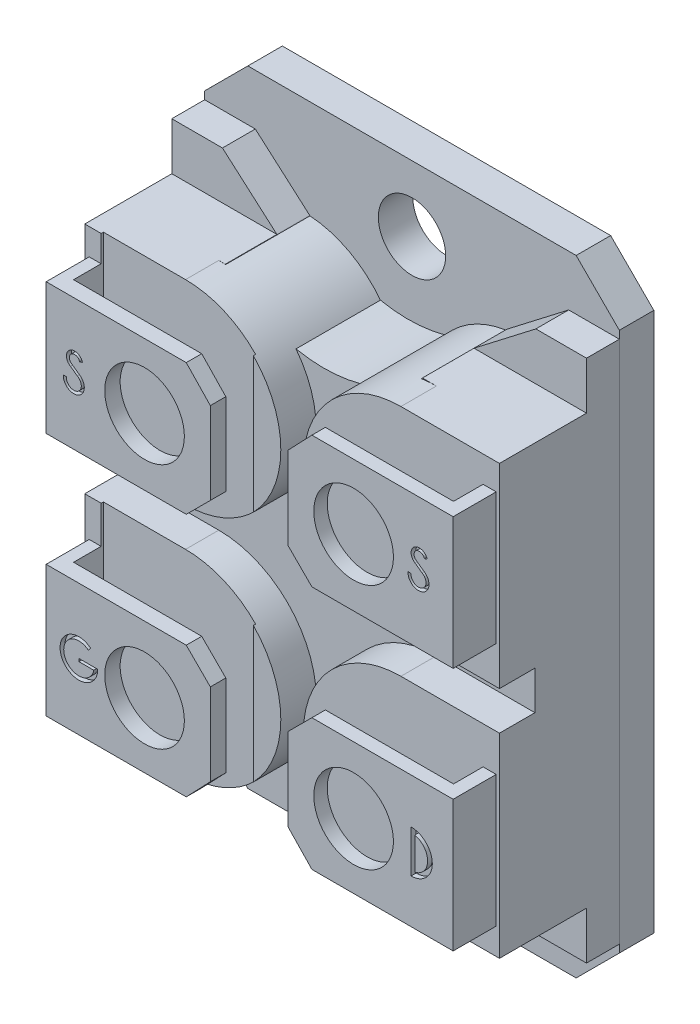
SolidWorks part; units mm, degrees
ref_plane "Front Plane" through (0, 0, 0) normal (0, 0, 1) x (1, 0, 0)
ref_plane "Top Plane" through (0, 0, 0) normal (0, 1, 0) x (1, 0, 0)
ref_plane "Right Plane" through (0, 0, 0) normal (1, 0, 0) x (0, 0, -1)
sketch "Sketch1" plane through (0, 0, 0) normal (0, 0, 1) x (1, 0, 0)
  line L0 (12.625, 60.3009) -> (12.625, -9.7877) construction
  line L1 (2.63, 0) -> (10.575, 0)
  line L2 (0, 2.63) -> (0, 35.47)
  line L3 (2.63, 38.1) -> (22.62, 38.1)
  line L4 (25.25, 2.63) -> (25.25, 35.47)
  line L5 (-10.9957, 19.05) -> (41.3267, 19.05) construction
  line L6 (2.63, 0) -> (0, 2.63)
  line L7 (22.62, 38.1) -> (25.25, 35.47)
  line L8 (22.62, 0) -> (25.25, 2.63)
  line L9 (14.675, 0) -> (22.62, 0)
  line L10 (2.63, 38.1) -> (0, 35.47)
  line L11 (10.575, 3.85) -> (10.575, 0)
  line L12 (14.675, 3.85) -> (14.675, 0)
  arc A0 (14.675, 3.85) -> (10.575, 3.85) centre (12.625, 3.85) ccw
  circle A1 centre (12.625, 34.1) radius 2.05
  dimension "D8" = 4.1
  dimension "D10" = 4.1
  dimension "D1" = 2.63
  dimension "D2" = 2.63
  dimension "D3" = 32.84
  dimension "D4" = 2.63
  dimension "D5" = 19.99
  dimension "D6" = 3.7194
  dimension "D7" = 3.85
  dimension "D9" = 4
extrude "Extrude1" add sketch "Sketch1" along normal blind 2.1
sketch "Sketch2" plane through (0, 0, 2.1) normal (0, 0, 1) x (1, 0, 0)
  line L0 (12.625, 40.0046) -> (12.625, -0.5619) construction
  line L1 (-6.4568, 19.05) -> (27.3251, 19.05) construction
  line L2 (0, 32.1) -> (0, 20.225)
  line L3 (0, 35.47) -> (0, 2.63) construction
  line L4 (0, 20.225) -> (6, 20.225)
  line L5 (0, 32.1) -> (6, 32.1)
  line L6 (0, 6) -> (6, 6)
  line L7 (0, 6) -> (0, 17.875)
  line L8 (0, 17.875) -> (6, 17.875)
  line L9 (25.25, 32.1) -> (19.25, 32.1)
  line L10 (25.25, 32.1) -> (25.25, 20.225)
  line L11 (25.25, 20.225) -> (19.25, 20.225)
  line L12 (25.25, 17.875) -> (19.25, 17.875)
  line L13 (25.25, 6) -> (25.25, 17.875)
  line L14 (25.25, 6) -> (19.25, 6)
  arc A0 (6, 20.225) -> (6, 32.1) centre (6, 26.1625) ccw
  arc A1 (6, 17.875) -> (6, 6) centre (6, 11.9375) cw
  arc A2 (19.25, 20.225) -> (19.25, 32.1) centre (19.25, 26.1625) cw
  arc A3 (19.25, 17.875) -> (19.25, 6) centre (19.25, 11.9375) ccw
  dimension "D3" = 5.9375
  dimension "D5" = 6
  dimension "D1" = 19.05
  dimension "D2" = 12.625
  dimension "D4" = 11.875
  dimension "D6" = 6
extrude "Extrude2" add sketch "Sketch2" along normal blind 7.3
sketch "Sketch3" plane through (0, 0, 2.1) normal (0, 0, 1) x (1, 0, 0)
  line L0 (-7.4463, 19.05) -> (33.1909, 19.05) construction
  line L1 (0, 35.47) -> (0, 32.1) construction
  line L2 (0, 35) -> (3.0841, 35)
  line L3 (3.0841, 35) -> (6.4, 32.1)
  line L4 (25.25, 35) -> (22.1659, 35)
  line L5 (25.25, 32.1) -> (25.25, 35.47) construction
  line L6 (22.1659, 35) -> (18.4, 32.1)
  line L7 (0, 3.1) -> (3.0841, 3.1)
  line L8 (3.0841, 3.1) -> (6.4, 6)
  line L9 (0, 32.1) -> (0, 20.225) construction
  line L10 (25.25, 3.1) -> (22.1659, 3.1)
  line L11 (22.1659, 3.1) -> (18.4, 6)
  line L12 (0, 35) -> (0, 3.1)
  line L13 (25.25, 35) -> (25.25, 3.1)
  arc A0 (6.4, 32.1) -> (18.4, 32.1) centre (12.4, 38.1) ccw
  arc A3 (6.4, 6) -> (18.4, 6) centre (12.4, 0) cw
  dimension "D9" = 19.05
  dimension "D5" = 8.4853
  dimension "D1" = 3.1
  dimension "D2" = 3.0841
  dimension "D3" = 3.0841
  dimension "D4" = 2.9
  dimension "D6" = 12
  dimension "D7" = 6.4
  dimension "D8" = 12.4
extrude "Extrude3" add sketch "Sketch3" along normal blind 5.14
sketch "Sketch4" plane through (0, 0, 7.24) normal (0, 0, 1) x (1, 0, 0)
  line L0 (19.25, 32.1) -> (25.25, 32.1) construction
  line L1 (0, 35) -> (25.25, 35)
  line L2 (0, 35) -> (0, 32.1)
  line L3 (0, 32.1) -> (25.25, 32.1)
  line L4 (25.25, 35) -> (25.25, 32.1)
  line L5 (0, 19.05) -> (31.7068, 19.05) construction
  line L6 (0, 20.225) -> (0, 17.875) construction
  line L7 (25.25, 3.1) -> (25.25, 6)
  line L8 (0, 3.1) -> (25.25, 3.1)
  line L9 (0, 3.1) -> (0, 6)
  line L10 (0, 6) -> (25.25, 6)
  dimension "D1" = 25.25
extrude "Cut-Extrude1" cut sketch "Sketch4" against normal blind 3.14
sketch "Sketch5" plane through (0, 0, 9.4) normal (0, 0, 1) x (1, 0, 0)
  line L0 (0, 32.1) -> (0, 20.225) construction
  line L1 (0, 30.5) -> (8.8, 30.5)
  line L2 (0, 30.5) -> (0, 22.5)
  line L3 (0, 22.5) -> (8.8, 22.5)
  line L4 (10.2666, 28.9666) -> (10.2666, 23.9666)
  line L5 (0, 19.05) -> (32.5245, 19.05) construction
  line L6 (0, 20.225) -> (0, 17.875) construction
  line L7 (10.2666, 23.9666) -> (8.8, 22.5)
  line L8 (0, 7.6) -> (0, 15.6)
  line L9 (10.2666, 28.9666) -> (8.8, 30.5)
  line L10 (0, 7.6) -> (8.8, 7.6)
  line L11 (10.2666, 9.1334) -> (8.8, 7.6)
  line L12 (10.2666, 9.1334) -> (10.2666, 14.1334)
  line L13 (10.2666, 14.1334) -> (8.8, 15.6)
  line L14 (0, 15.6) -> (8.8, 15.6)
  line L15 (12.625, 38.1) -> (12.625, -1.2686) construction
  line L16 (22.62, 38.1) -> (2.63, 38.1) construction
  line L17 (14.9834, 23.9666) -> (16.45, 22.5)
  line L18 (14.9834, 28.9666) -> (14.9834, 23.9666)
  line L19 (14.9834, 28.9666) -> (16.45, 30.5)
  line L20 (25.25, 30.5) -> (16.45, 30.5)
  line L21 (25.25, 30.5) -> (25.25, 22.5)
  line L22 (25.25, 22.5) -> (16.45, 22.5)
  line L23 (14.9834, 14.1334) -> (16.45, 15.6)
  line L24 (14.9834, 9.1334) -> (14.9834, 14.1334)
  line L25 (14.9834, 9.1334) -> (16.45, 7.6)
  line L26 (25.25, 7.6) -> (16.45, 7.6)
  line L27 (25.25, 7.6) -> (25.25, 15.6)
  line L28 (25.25, 15.6) -> (16.45, 15.6)
  dimension "D1" = 8
  dimension "D2" = 7.6
  dimension "D3" = 8.8
  dimension "D4" = 8.8
  dimension "D5" = 5
  dimension "D6" = 1.4666
  dimension "D7" = 1.4666
extrude "Extrude4" add sketch "Sketch5" along normal blind 2.62
ref_plane "Plane1" through (14.9834, 0, 0) normal (-1, 0, 0) x (0, 0, 1)
sketch "Sketch6" plane through (14.9834, 0, 0) normal (-1, 0, 0) x (0, 0, 1)
  line L1 (9.4, 30.5) -> (11.2, 30.5)
  line L2 (9.4, 30.5) -> (9.4, 7.6)
  line L3 (9.4, 7.6) -> (11.2, 7.6)
  line L4 (11.2, 30.5) -> (11.2, 7.6)
  dimension "D1" = 1.8
  dimension "D2" = 22.9
extrude "Cut-Extrude2" cut sketch "Sketch6" against normal blind 9.27
ref_plane "Plane2" through (25.25, 0, 0) normal (1, 0, 0) x (0, 0, -1)
sketch "Sketch7" plane through (25.25, 0, 0) normal (1, 0, 0) x (0, 0, -1)
  line L1 (-14.223, 31.5238) -> (-9.4, 31.5238)
  line L2 (-14.223, 31.5238) -> (-14.223, 5.1627)
  line L3 (-14.223, 5.1627) -> (-9.4, 5.1627)
  line L4 (-9.4, 31.5238) -> (-9.4, 5.1627)
extrude "Cut-Extrude4" cut sketch "Sketch7" against normal blind 0.2
ref_plane "Plane3" through (10.2666, 0, 0) normal (1, 0, 0) x (0, 0, -1)
sketch "Sketch8" plane through (10.2666, 0, 0) normal (1, 0, 0) x (0, 0, -1)
  line L1 (-9.2639, 32.3506) -> (-11.079, 32.3506)
  line L2 (-9.2639, 32.3506) -> (-9.2639, 4.4395)
  line L3 (-9.2639, 4.4395) -> (-11.079, 4.4395)
  line L4 (-11.079, 32.3506) -> (-11.079, 4.4395)
extrude "Cut-Extrude6" cut sketch "Sketch8" against normal blind 9.27
sketch "Sketch9" plane through (0, 0, 0) normal (-1, 0, 0) x (0, 0, 1)
  line L1 (12.02, 30.5) -> (9.4, 30.5)
  line L2 (12.02, 30.5) -> (12.02, 6)
  line L3 (12.02, 6) -> (9.4, 6)
  line L4 (9.4, 30.5) -> (9.4, 6)
extrude "Cut-Extrude7" cut sketch "Sketch9" against normal blind 0.27
sketch "Sketch10" plane through (0, 0, 12.02) normal (0, 0, 1) x (1, 0, 0)
  line L0 (6.26, 39.722) -> (6.26, -1.4806) construction
  line L1 (18.99, 39.722) -> (18.99, -1.4806) construction
  line L2 (34.6044, 26.55) -> (-11.7573, 26.55) construction
  line L3 (-8.789, 11.55) -> (32.5549, 11.55) construction
  circle A0 centre (6.26, 26.55) radius 2.425
  circle A1 centre (18.99, 11.55) radius 2.425
  circle A2 centre (18.99, 26.55) radius 2.425
  circle A3 centre (6.26, 11.55) radius 2.425
  dimension "D5" = 4.85
  dimension "D1" = 15
  dimension "D2" = 11.55
  dimension "D3" = 12.73
  dimension "D4" = 6.26
extrude "Cut-Extrude8" cut sketch "Sketch10" against normal blind 1
sketch "Sketch11" plane through (0, 0, 12.02) normal (0, 0, 1) x (1, 0, 0)
  line L0 (2.3217, 26.5957) -> (1.8189, 26.951)
  line L1 (1.7403, 26.7864) -> (2.1693, 26.4762)
  line L2 (2.3101, 27.2995) -> (2.4839, 27.3492)
  line L3 (1.497, 26.106) -> (1.3152, 26.1189)
  arc A0 (2.4839, 27.3492) -> (1.7403, 26.7864) centre (2.0031, 27.2118) ccw
  arc A1 (1.3152, 26.1189) -> (2.3217, 26.5957) centre (1.9528, 26.0737) ccw
  arc A2 (2.3101, 27.2995) -> (1.8189, 26.951) centre (2.0031, 27.2118) ccw
  arc A3 (1.497, 26.106) -> (2.1693, 26.4762) centre (1.9528, 26.0737) ccw
  dimension "D1" = 1
  dimension "D2" = 0.1807
extrude "Cut-Extrude9" cut sketch "Sketch11" against normal blind 0.3
sketch "Sketch12" plane through (0, 0, 12.02) normal (0, 0, 1) x (1, 0, 0)
  line L0 (23.309, 26.71) -> (22.8062, 27.0654)
  line L1 (22.7276, 26.9007) -> (23.1565, 26.5905)
  line L2 (23.2974, 27.4138) -> (23.4712, 27.4635)
  line L3 (22.4842, 26.2203) -> (22.3025, 26.2332)
  arc A0 (23.4712, 27.4635) -> (22.7276, 26.9007) centre (22.9904, 27.3261) ccw
  arc A1 (22.3025, 26.2332) -> (23.309, 26.71) centre (22.9401, 26.188) ccw
  arc A2 (23.2974, 27.4138) -> (22.8062, 27.0654) centre (22.9904, 27.3261) ccw
  arc A3 (22.4842, 26.2203) -> (23.1565, 26.5905) centre (22.9401, 26.188) ccw
extrude "Cut-Extrude10" cut sketch "Sketch12" against normal blind 0.3
ref_plane "Plane4" through (25.25, 20.225, 9.4) normal (0, 1, 0) x (-1, 0, 0)
sketch "Sketch14" plane through (0, 0, 12.02) normal (0, 0, 1) x (1, 0, 0)
  line L0 (2.2629, 11.6333) -> (3.41, 11.6333)
  line L1 (2.8422, 12.353) -> (2.9822, 12.5269)
  line L2 (2.2629, 11.6333) -> (2.2629, 11.4638)
  line L3 (2.2629, 11.4638) -> (3.1712, 11.4638)
  arc A0 (2.9822, 12.5269) -> (3.41, 11.6333) centre (2.2629, 11.6333) ccw
  arc A1 (2.8422, 12.353) -> (3.1712, 11.4638) centre (2.2629, 11.6333) ccw
extrude "Cut-Extrude11" cut sketch "Sketch14" against normal blind 0.3
sketch "Sketch15" plane through (0, 0, 12.02) normal (0, 0, 1) x (1, 0, 0)
  line L0 (22.4906, 12.8586) -> (22.4906, 10.2755)
  line L1 (22.7187, 12.5472) -> (22.7187, 10.5869)
  arc A0 (22.4906, 10.2755) -> (22.4906, 12.8586) centre (22.4906, 11.5671) ccw
  arc A1 (22.7187, 10.5869) -> (22.7187, 12.5472) centre (22.4906, 11.5671) ccw
extrude "Cut-Extrude12" cut sketch "Sketch15" against normal blind 0.3
sketch "Sketch16" plane through (25.25, 0, 0) normal (1, 0, 0) x (0, 0, -1)
  line L1 (-2.1, 35.47) -> (0, 35.47)
  line L2 (-2.1, 35.47) -> (-2.1, 2.63)
  line L3 (-2.1, 2.63) -> (0, 2.63)
  line L4 (0, 35.47) -> (0, 2.63)
extrude "Extrude5" add sketch "Sketch16" along normal blind 0.0001
sketch "Sketch17" plane through (0, 0, 0) normal (-1, 0, 0) x (0, 0, 1)
  line L1 (0, 35.47) -> (2.1, 35.47)
  line L2 (0, 35.47) -> (0, 2.63)
  line L3 (0, 2.63) -> (2.1, 2.63)
  line L4 (2.1, 35.47) -> (2.1, 2.63)
extrude "Extrude6" add sketch "Sketch17" along normal blind 0.0001
ref_plane "Plane5" through (0, 19.05, 0) normal (0, 1, 0) x (1, 0, 0)
